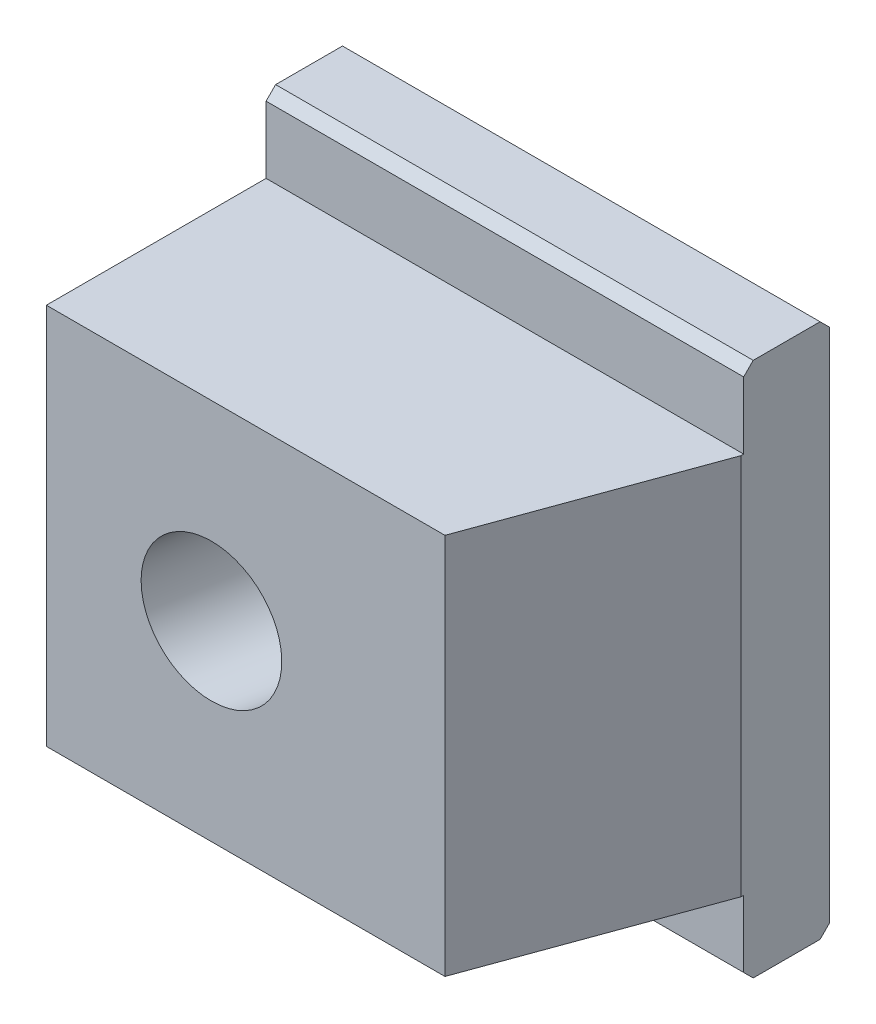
SolidWorks part; units mm, degrees
ref_plane "Plan de face" through (0, 0, 0) normal (0, 0, 1) x (1, 0, 0)
ref_plane "Plan de dessus" through (0, 0, 0) normal (0, 1, 0) x (1, 0, 0)
ref_plane "Plan de droite" through (0, 0, 0) normal (1, 0, 0) x (0, 0, -1)
imported_body "Importée1"
sketch "Esquisse2" plane through (121, 0, 0) normal (-1, 0, 0) x (0, 0, 1)
  circle A0 centre (-8, -29.85) radius 2.1 construction
  circle A1 centre (-8, -29.85) radius 2.1
  circle A2 centre (-21, -53.85) radius 2.1 construction
  circle A3 centre (-21, -53.85) radius 2.1
extrude "Extrusion1" add sketch "Esquisse2" against normal blind 13
hole_wizard "Dégagement M11" positions "Esquisse3D1" profile "Esquisse4" hole size "M1" standard "ISO"
sketch3d "Esquisse3D1"
  line L0 (121, -21.85, -2) -> (121, -61.85, -2) construction
  line L1 (121, -21.85, -25) -> (121, -21.85, -2) construction
  line L2 (121, -61.85, -2) -> (121, -61.85, -25) construction
  point P0 (121, -27.85, -10)
  point P2 (121, -55.85, -23)
  dimension "D1" = 8
  dimension "D2" = 21
  dimension "D3" = 6
  dimension "D4" = 6
sketch "Esquisse4" plane through (121, -27.85, -10) normal (0, 1, 0) x (0, 0, 1)
  line L0 (0, 0) -> (0, 12.2618)
  line L1 (0, 12.2618) -> (2.1, 11)
  line L2 (2.1, 11) -> (2.1, 0)
  line L5 (2.1, 0) -> (0, 0)
  line L10 (0, 12.2618) -> (-2.1, 11) construction
  line L11 (0, -6.35) -> (0, 107.95) construction
  dimension "Diamètre du perçage" = 4.2
  dimension "Profondeur du perçage" = 11
  dimension "Angle de pointe" = 118
